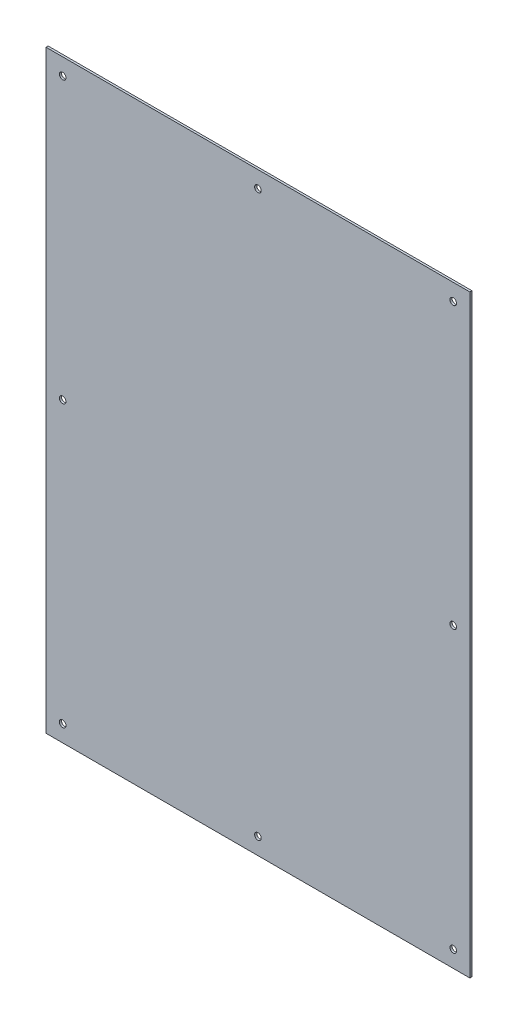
SolidWorks part; units mm, degrees
ref_plane "Front" through (0, 0, 0) normal (0, 0, 1) x (1, 0, 0)
ref_plane "Top" through (0, 0, 0) normal (0, 1, 0) x (1, 0, 0)
ref_plane "Right" through (0, 0, 0) normal (1, 0, 0) x (0, 0, -1)
sketch "Sketch1" plane through (0, 0, 0) normal (0, 0, 1) x (1, 0, 0)
  line L8 (473.075, -454.025) -> (473.075, 454.025)
  line L9 (-174.625, -454.025) -> (473.075, -454.025)
  line L10 (-174.625, 454.025) -> (-174.625, -454.025)
  line L11 (473.075, 454.025) -> (-174.625, 454.025)
  line L12 (473.075, -454.025) -> (473.075, 454.025)
  line L13 (-174.625, -454.025) -> (473.075, -454.025)
  line L14 (-174.625, 454.025) -> (-174.625, -454.025)
  line L15 (473.075, 454.025) -> (-174.625, 454.025)
  dimension "D1" = 25.4
extrude "Extrude1" add sketch "Sketch1" along normal blind 3.2512
hole_wizard "3/8 Clearance Hole1" positions "Sketch4" profile "Sketch3" hole size "3/8" standard "Ansi Inch"
sketch "Sketch4" plane through (0, 0, 3.2512) normal (0, 0, 1) x (1, 0, 0)
  point P0 (-149.225, 428.625)
  point P1 (-149.225, 0)
  point P2 (-149.225, -428.625)
  point P3 (149.225, -428.625)
  point P4 (447.675, -428.625)
  point P5 (447.675, 0)
  point P6 (447.675, 428.625)
  point P7 (149.225, 428.625)
sketch "Sketch3" plane through (-149.225, 428.625, 3.2512) normal (1, 0, 0) x (0, -1, 0)
  line L0 (0, 0) -> (0, 3.2512)
  line L1 (0, 3.2512) -> (5.0419, 3.2512)
  line L2 (5.0419, 3.2512) -> (5.0419, 0)
  line L5 (5.0419, 0) -> (0, 0)
  line L11 (0, -6.35) -> (0, 107.95) construction
  dimension "Thru Hole Dia." = 10.0838
  dimension "Thru Hole Depth" = 3.2512
